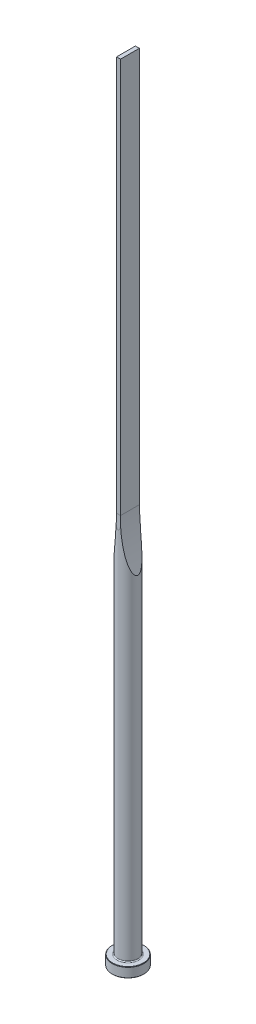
SolidWorks part; units mm, degrees
ref_plane "Front Plane" through (0, 0, 0) normal (0, 0, 1) x (1, 0, 0)
ref_plane "Top Plane" through (0, 0, 0) normal (0, 1, 0) x (1, 0, 0)
ref_plane "Right Plane" through (0, 0, 0) normal (1, 0, 0) x (0, 0, -1)
sketch "Sketch1" plane through (0, 0, 0) normal (0, 0, 1) x (1, 0, 0)
  line L0 (0, 0) -> (7.8, 0)
  line L1 (55, 0) -> (-55, 0) construction
  line L2 (8, 0.2) -> (8, 4.8)
  line L3 (7.8, 5) -> (5.5, 5)
  line L4 (5, 5.5) -> (5, 400)
  line L5 (0, 400) -> (5, 400)
  line L6 (8, 4.8) -> (7.8, 5)
  line L7 (7.8, 0) -> (8, 0.2)
  line L8 (0, 400) -> (0, 0)
  arc A0 (5, 5.5) -> (5.5, 5) centre (5.5, 5.5) ccw
  point P1 (8, 0)
  point P6 (8, 5)
  dimension "D4" = 0.5
  dimension "D1" = 5
  dimension "D2" = 8
  dimension "D3" = 5
  dimension "D5" = 400
revolve "Revolve1" add sketch "Sketch1" angle 360 about L8
sketch "Sketch2" plane through (0, 0, 0) normal (0, 0, 1) x (1, 0, 0)
  line L0 (1, 400) -> (1, 200)
  line L1 (5, 400) -> (-5, 400) construction
  line L2 (-1, 400) -> (-1, 200)
  line L3 (5, 400) -> (5, 173.467)
  line L4 (-5, 400) -> (-5, 173.467)
  line L5 (0, -8.8) -> (0, 8.8) construction
  line L6 (5, 400) -> (1, 400)
  line L8 (-1, 400) -> (-5, 400)
  arc A0 (1, 200) -> (5, 173.467) centre (91, 200) ccw
  arc A1 (-1, 200) -> (-5, 173.467) centre (-91, 200) cw
  dimension "D4" = 90
  dimension "D1" = 200
  dimension "D2" = 2
  dimension "D3" = 1
extrude "Cut-Extrude1" cut sketch "Sketch2" against normal mid plane 10
sketch "Sketch3" plane through (0, 0, 0) normal (1, 0, 0) x (0, 0, -1)
  line L0 (4.75, 400) -> (4.75, 200)
  line L1 (-4.899, 400) -> (4.899, 400) construction
  line L2 (-4.75, 400) -> (-4.75, 200)
  line L3 (5, 400) -> (5, 193.2965)
  line L4 (4.75, 400) -> (5, 400)
  line L5 (0, 8.8) -> (0, -8.8) construction
  line L6 (-5, 400) -> (-5, 193.2965)
  line L8 (-4.75, 400) -> (-5, 400)
  arc A0 (4.75, 200) -> (5, 193.2965) centre (94.75, 200) ccw
  arc A1 (-4.75, 200) -> (-5, 193.2965) centre (-94.75, 200) cw
  dimension "D2" = 90
  dimension "D1" = 200
  dimension "D3" = 9.5
  dimension "D4" = 4.75
extrude "Cut-Extrude2" cut sketch "Sketch3" against normal mid plane 10
